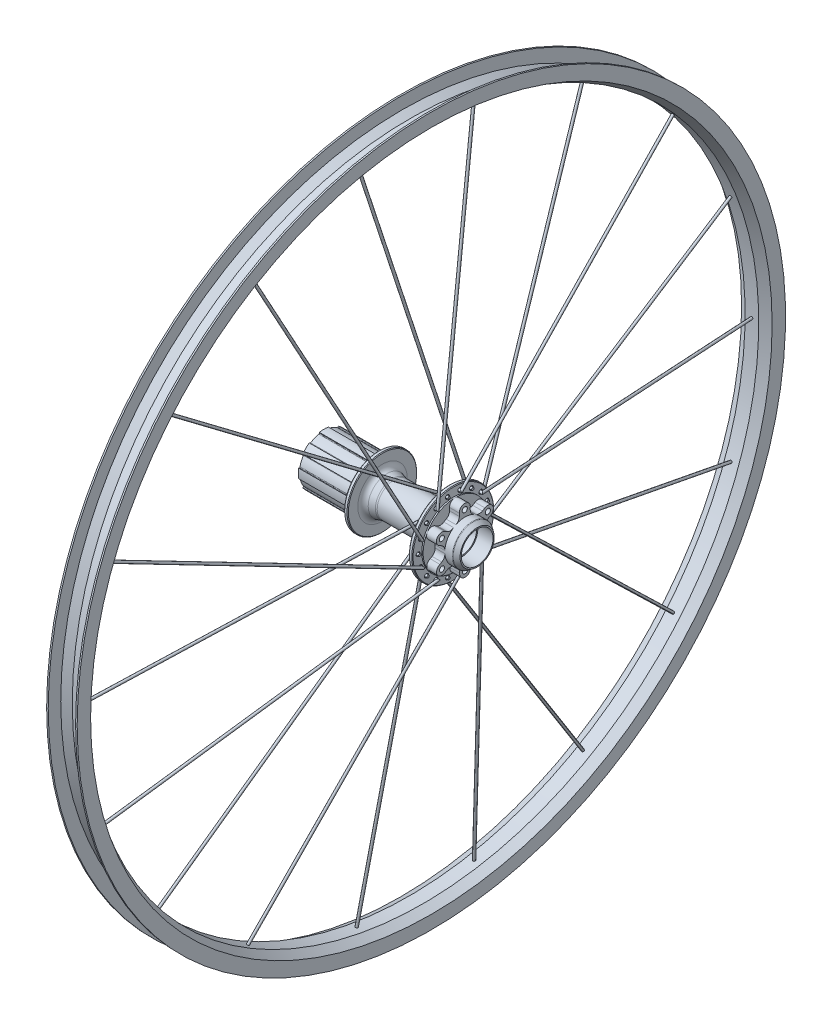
SolidWorks part; units mm, degrees
ref_plane "Plan1" through (0, 0, 0) normal (0, 0, 1) x (1, 0, 0)
ref_plane "Plan2" through (0, 0, 0) normal (0, 1, 0) x (1, 0, 0)
ref_plane "Plan3" through (0, 0, 0) normal (1, 0, 0) x (0, 0, -1)
sketch "Esquisse2" plane through (0, 0, 0) normal (0, 0, 1) x (1, 0, 0)
  line L0 (0, 13) -> (12.5, 13)
  line L1 (12.5, 13) -> (12.5, 12)
  line L2 (12.5, 12) -> (113, 12)
  line L3 (113, 12) -> (113, 13)
  line L4 (113, 13) -> (125.5, 13)
  line L5 (125.5, 13) -> (125.5, 14)
  line L6 (125.5, 14) -> (122.2608, 16.3137)
  line L7 (121.6795, 16.5) -> (107.5, 16.5)
  line L8 (107.5, 16.5) -> (107.5, 26.25)
  line L9 (107.5, 26.25) -> (106.38, 26.25)
  line L10 (106.38, 26.25) -> (106, 33.5)
  line L11 (106, 33.5) -> (103, 33.5)
  line L12 (103, 33.5) -> (103, 20.2482)
  line L13 (99.2941, 15.4185) -> (94.6358, 14.1704)
  line L14 (93.3417, 14) -> (57.6583, 14)
  line L15 (56.3642, 14.1704) -> (51.7059, 15.4185)
  line L16 (48, 20.2482) -> (48, 28.5)
  line L17 (48, 28.5) -> (45, 28.5)
  line L18 (45, 28.5) -> (44.8029, 24.7383)
  line L19 (39.8097, 20) -> (0, 20)
  line L20 (0, 20) -> (0, 13)
  line L21 (-10, 0) -> (170, 0) construction
  arc A0 (44.8029, 24.7383) -> (39.8097, 20) centre (39.8097, 25) cw
  arc A1 (51.7059, 15.4185) -> (48, 20.2482) centre (53, 20.2482) cw
  arc A2 (57.6583, 14) -> (56.3642, 14.1704) centre (57.6583, 19) cw
  arc A3 (94.6358, 14.1704) -> (93.3417, 14) centre (93.3417, 19) cw
  arc A4 (103, 20.2482) -> (99.2941, 15.4185) centre (98, 20.2482) cw
  arc A5 (122.2608, 16.3137) -> (121.6795, 16.5) centre (121.6795, 15.5) ccw
  point P30 (57, 14)
  point P33 (94, 14)
  point P38 (122, 16.5)
  dimension "D26" = 5
  dimension "D27" = 1
  dimension "D1" = 12
  dimension "D2" = 13
  dimension "D3" = 14
  dimension "D4" = 12.5
  dimension "D5" = 55
  dimension "D6" = 3
  dimension "D7" = 3
  dimension "D8" = 90
  dimension "D9" = 12.5
  dimension "D10" = 14
  dimension "D11" = 48
  dimension "D12" = 93
  dimension "D13" = 165
  dimension "D14" = 165
  dimension "D15" = 20
  dimension "D16" = 28.5
  dimension "D17" = 26.25
  dimension "D18" = 16.5
  dimension "D19" = 33.5
  dimension "D20" = 4.5
  dimension "D21" = 100.5
  dimension "D22" = 93
  dimension "D23" = 3.5
  dimension "D24" = 37
  dimension "D25" = 9
revolve "Base-Révolution" add sketch "Esquisse2" angle 360 about L21
other "Perçage1"
sketch "Esquisse3" plane through (103, 0, 0) normal (-1, 0, 0) x (0, 0, 1)
  circle A0 centre (29, 0) radius 1.1
  dimension "D1" = 2.2
  dimension "D2" = 29
chamfer "Chanfrein1" distance 0.5 angle 45
pattern_circular "Répétition circulaire1" count 18 over 360 about axis through (-10, 0, 0) along (1, 0, 0)
other "Perçage2"
sketch "Esquisse4" plane through (48, 0, 0) normal (1, 0, 0) x (0, 0, -1)
  line L0 (0, 30.4612) -> (0, -29.5388) construction
  circle A0 centre (0, 24) radius 1.1
  dimension "D1" = 2.2
  dimension "D2" = 24
chamfer "Chanfrein2" [suppressed] distance 0.5 angle 45
pattern_circular "Répétition circulaire2" [suppressed] count 18 over 360 about axis through (-10, 0, 0) along (1, 0, 0)
sketch "Esquisse5" plane through (107.5, 0, 0) normal (1, 0, 0) x (0, 0, -1)
  line L0 (-0.1416, 31.7495) -> (-0.1416, -18.2505) construction
  line L1 (4.3211, 21.1713) -> (4.3211, 19.3744)
  line L2 (-4.637, 21.5474) -> (-4.637, 19.2192)
  arc A0 (4.3211, 21.1713) -> (-4.637, 21.5474) centre (-0.1416, 21.7495) ccw
  circle A1 centre (0, 0) radius 26.25 construction
  arc A2 (4.3211, 19.3744) -> (7.1534, 14.8687) centre (9.3211, 19.3744) ccw
  arc A3 (7.1534, 14.8687) -> (-7.3959, 14.7496) centre (0, 0) ccw
  circle A4 centre (0, 0) radius 16.5 construction
  arc A5 (-7.3959, 14.7496) -> (-4.637, 19.2192) centre (-9.637, 19.2192) ccw
  dimension "D1" = 9
  dimension "D2" = 10
  dimension "D3" = 10
extrude "Boss.-Extru.1" add sketch "Esquisse5" along normal blind 8
hole_wizard "Perçage3" positions "Esquisse8" profile "Esquisse7" tap size "M5x0.8" standard "ISO"
sketch "Esquisse8" plane through (115.5, 0, 0) normal (1, 0, 0) x (0, 0, -1)
  circle A2 centre (0, 0) radius 13 construction
  point P0 (-0.1416, 21.75)
  dimension "D1" = 21.75
sketch "Esquisse7" plane through (115.5, 21.75, 0.1416) normal (0, 1, 0) x (0, 0, -1)
  line L0 (0, 0) -> (0, 17.2618)
  line L1 (0, 17.2618) -> (2.1, 16)
  line L2 (2.1, 16) -> (2.1, 0)
  line L5 (2.1, 0) -> (0, 0)
  line L10 (0, 17.2618) -> (-2.1, 16) construction
  line L11 (0, -6.35) -> (0, 107.95) construction
  dimension "Diamètre du perçage" = 4.2
  dimension "Profondeur du perçage" = 16
  dimension "Angle de pointe" = 118
pattern_circular "Répétition circulaire3" count 6 every 60 about axis through (-10, 0, 0) along (1, 0, 0)
chamfer "Chanfrein3" distance 0.5 angle 45
sketch "Esquisse9" plane through (0, 0, 0) normal (-1, 0, 0) x (0, 0, 1)
  line L0 (0, 0) -> (0, 30) construction
  line L1 (3.75, 20.6625) -> (3.75, 19.6453)
  line L2 (-3.75, 20.6625) -> (-3.75, 19.6453)
  arc A0 (3.75, 19.6453) -> (-3.75, 19.6453) centre (0, 0) ccw
  arc A1 (3.75, 20.6625) -> (-3.75, 20.6625) centre (0, 0) ccw
  dimension "D1" = 42
  dimension "D2" = 7.5
  dimension "D3" = 3.75
extrude "Extrusion1" add sketch "Esquisse9" against normal up to next
fillet "Congé1" radius 0.5
fillet "Congé2" radius 0.5
pattern_circular "Répétition circulaire4" count 8 every 45 about axis through (-10, 0, 0) along (1, 0, 0)
sketch "Esquisse11" plane through (0, 0, 0) normal (0, 0, 1) x (1, 0, 0)
  line L0 (48, 0) -> (103, 0) construction
  line L2 (-10, 0) -> (170, 0) construction
  line L3 (48, -27.9716) -> (48, 27.9716) construction
  line L4 (103, 32.9716) -> (103, -32.9716) construction
  line L5 (75.5, 0) -> (75.5, 48.7502) construction
  line L6 (63, 290) -> (63, 279)
  line L7 (63, 279) -> (69.9282, 275)
  line L8 (69.9282, 275) -> (81.0718, 275)
  line L10 (88, 279) -> (81.0718, 275)
  line L11 (88, 290) -> (88, 279)
  dimension "D1" = 15
  dimension "D2" = 12.5
  dimension "D3" = 11
  dimension "D4" = 275
  dimension "D5" = 60
revolve "Révol.-Mince1" add sketch "Esquisse11" angle 360 about L0
sketch3d "Esquisse3D1"
  line L0 (102.8976, 18.6408, 22.2153) -> (107.5, 18.6408, 22.2153)
  line L2 (105.6516, 18.6408, 22.2153) -> (103.5, 18.6408, 22.2153) construction
  line L3 (101.9034, 18.5752, 23.1053) -> (74.5744, 0, 275)
  arc A1 (102.8976, 18.6408, 22.2153) -> (101.9034, 18.5752, 23.1053) centre (102.8976, 18.5673, 23.2126) ccw
  point P7 (102, 18.6408, 22.2153)
  point P9 (102.8976, 19.5646, 23.2861)
  dimension "D2" = 1
  dimension "D1" = 1
sketch "Esquisse12" plane through (107.5, 0, 0) normal (1, 0, 0) x (0, 0, -1)
  circle A0 centre (-22.2153, 18.6408) radius 1
  circle A1 centre (-22.2153, 18.6408) radius 1.1 construction
  dimension "D1" = 2
sweep "Balayage1" add profiles "Esquisse12" path "Esquisse3D1"
sketch3d "Esquisse3D2"
  line L0 (107.5, 18.6408, -22.2153) -> (103, 18.6408, -22.2153)
  line L6 (107.5, 18.6408, -22.2153) -> (75.2353, 0, -275)
  line L7 (105.7383, 18.6408, -22.2153) -> (103.5, 18.6408, -22.2153) construction
  dimension "D1" = 4.5
sketch "Esquisse13" plane through (103, 0, 0) normal (-1, 0, 0) x (0, 0, 1)
  circle A0 centre (-22.2153, 18.6408) radius 1
  dimension "D1" = 2
sweep "Balayage2" add profiles "Esquisse13" path "Esquisse3D2"
sketch3d "Esquisse3D3" [suppressed]
  line L0 (48, -18.3851, -15.4269) -> (44.1342, -18.3851, -15.4269)
  line L1 (45.3022, -18.3851, -15.4269) -> (47.5, -18.3851, -15.4269) construction
  line L2 (43.142, -19.5083, -15.3594) -> (75.4491, -275, 0)
  arc A0 (44.1342, -18.3851, -15.4269) -> (43.142, -19.5083, -15.3594) centre (44.1342, -19.3833, -15.3669) ccw
  point P7 (43, -18.3851, -15.4269)
  point P8 (44.1342, -19.3233, -14.3687)
  dimension "D2" = 1
  dimension "D1" = 5
sketch "Esquisse14" [suppressed] plane through (48, 0, 0) normal (1, 0, 0) x (0, 0, -1)
  circle A0 centre (15.4269, -18.3851) radius 1
  dimension "D1" = 2
sweep "Balayage3" [suppressed] add profiles "Esquisse14" path "Esquisse3D3"
mirror "Symétrie1" [suppressed] about plane through (0, 0, 0) normal (0, 1, 0)
pattern_circular "Répétition circulaire6" count 9 over 360 about axis through (-10, 0, 0) along (1, 0, 0)
